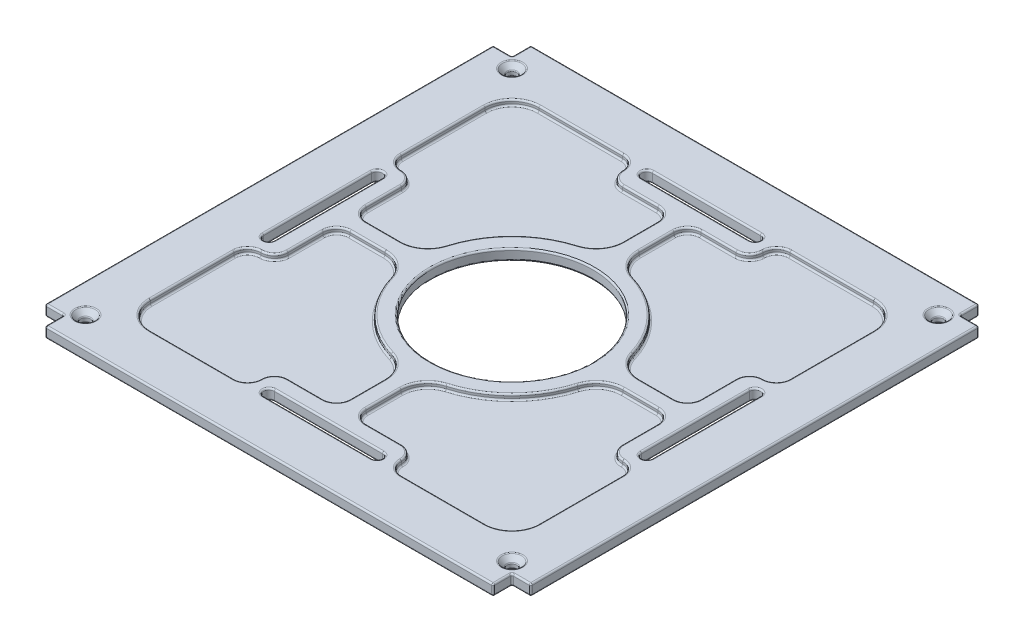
SolidWorks part; units mm, degrees
ref_plane "Front Plane" through (0, 0, 0) normal (0, 0, 1) x (1, 0, 0)
ref_plane "Top Plane" through (0, 0, 0) normal (0, 1, 0) x (1, 0, 0)
ref_plane "Right Plane" through (0, 0, 0) normal (1, 0, 0) x (0, 0, -1)
imported_body "Stock-cubesat - Master-1"
sketch "Sketch1" plane through (0, 50, 0) normal (0, 1, 0) x (1, 0, 0)
  circle A0 centre (0, 0) radius 15
extrude "Cut-Extrude1" cut sketch "Sketch1" against normal blind 10
sketch "Sketch2" plane through (0, 50, 0) normal (0, 1, 0) x (1, 0, 0)
  line L0 (-35, 10) -> (-35, -10) construction
  line L1 (-34, 10) -> (-34, -10)
  line L2 (-36, 10) -> (-36, -10)
  line L3 (-41.5, -41.5) -> (0, 0) construction
  line L4 (0, 0) -> (41.5, -41.5) construction
  line L5 (-35, 0) -> (0, 0) construction
  line L6 (10, -35) -> (-10, -35) construction
  line L7 (10, -34) -> (-10, -34)
  line L8 (10, -36) -> (-10, -36)
  line L9 (-10, 35) -> (10, 35) construction
  line L10 (-10, 34) -> (10, 34)
  line L11 (-10, 36) -> (10, 36)
  line L12 (35, -10) -> (35, 10) construction
  line L13 (34, -10) -> (34, 10)
  line L14 (36, -10) -> (36, 10)
  arc A0 (-34, 10) -> (-36, 10) centre (-35, 10) ccw
  arc A1 (-36, -10) -> (-34, -10) centre (-35, -10) ccw
  arc A2 (10, -34) -> (10, -36) centre (10, -35) cw
  arc A3 (-10, -36) -> (-10, -34) centre (-10, -35) cw
  arc A4 (-10, 34) -> (-10, 36) centre (-10, 35) cw
  arc A5 (10, 36) -> (10, 34) centre (10, 35) cw
  arc A6 (34, -10) -> (36, -10) centre (35, -10) ccw
  arc A7 (36, 10) -> (34, 10) centre (35, 10) ccw
  point P2 (-35, 0)
  point P16 (0, -35)
  point P23 (0, 35)
  point P30 (35, 0)
extrude "Cut-Extrude2" cut sketch "Sketch2" against normal blind 10
sketch "Sketch3" plane through (0, 50, 0) normal (0, 1, 0) x (1, 0, 0)
  line L0 (0, 31) -> (0, -31) construction
  line L1 (31, -31) -> (-31, -31)
  line L2 (31, -31) -> (31, 31)
  line L3 (31, 31) -> (-31, 31)
  line L4 (-31, -31) -> (-31, 31)
  line L5 (31, -31) -> (-31, 31) construction
  line L6 (31, 31) -> (-31, -31) construction
  line L7 (-31, 0) -> (31, 0) construction
  line L8 (-1.5, 31) -> (-1.5, -31)
  line L9 (-31, -1.5) -> (31, -1.5)
  line L10 (1.5, 31) -> (1.5, -31)
  line L11 (-31, 1.5) -> (31, 1.5)
  line L12 (-13, 36) -> (-36, 36)
  line L13 (-36, 13) -> (-36, 36)
  line L14 (-36, 13) -> (-31, 13)
  line L15 (-13, 36) -> (-13, 31)
  line L16 (13, 36) -> (36, 36)
  line L17 (36, 13) -> (36, 36)
  line L18 (13, 36) -> (13, 31)
  line L19 (36, 13) -> (31, 13)
  line L20 (36, -13) -> (36, -36)
  line L21 (13, -36) -> (36, -36)
  line L22 (36, -13) -> (31, -13)
  line L23 (13, -36) -> (13, -31)
  line L24 (-13, -36) -> (-36, -36)
  line L25 (-36, -13) -> (-36, -36)
  line L26 (-13, -36) -> (-13, -31)
  line L27 (-36, -13) -> (-31, -13)
  circle A2 centre (0, 0) radius 18
  circle A3 centre (0, 0) radius 18
  point P42 (0, 0)
  dimension "D2" = 1.5
  dimension "D4" = 4
  dimension "D1" = 3
  dimension "D3" = 1.5
extrude "Cut-Extrude5" cut sketch "Sketch3" against normal blind 1 contours L4 L1 L2 L3 A3 | A3 L11 L2 L3 L10 | A3 L10 L1 L2 L9 | A3 L9 L4 L1 L8 | L15 L12 L13 L14 L4 L3 | L19 L17 L16 L18 L3 L2 | L23 L21 L20 L22 L2 L1 | L27 L25 L24 L26 L1 L4
fillet "Fillet1" radius 5 12 edges at (1.5, 49.5, -17.9374) (17.9374, 49.5, -1.5) (-36, 49.5, 36) (36, 49.5, 36) (-1.5, 49.5, 17.9374) (-17.9374, 49.5, 1.5) (1.5, 49.5, 17.9374) (17.9374, 49.5, 1.5) (36, 49.5, -36) (-36, 49.5, -36) (-1.5, 49.5, -17.9374) (-17.9374, 49.5, -1.5)
fillet "Fillet4" radius 2.5 24 edges at (-36, 49.5, 13) (-31, 49.5, -1.5) (-31, 49.5, 1.5) (31, 49.5, 1.5) (36, 49.5, 13) (1.5, 49.5, -31) (13, 49.5, -36) (-13, 49.5, -36) (-13, 49.5, -31) (-1.5, 49.5, -31) (13, 49.5, -31) (-36, 49.5, -13) (-31, 49.5, -13) (31, 49.5, -1.5) (31, 49.5, -13) (36, 49.5, -13) (31, 49.5, 13) (-13, 49.5, 36) (-1.5, 49.5, 31) (-13, 49.5, 31) (-31, 49.5, 13) (1.5, 49.5, 31) (13, 49.5, 31) (13, 49.5, 36)
fillet "Fillet5" radius 0.3 99 edges at (13.7322, 50, 35.2678) (2.2322, 50, 30.2678) (-31.7322, 49, 12.2678) (-2.2322, 50, 30.2678) (31.7322, 49, -12.2678) (-31.7322, 49, -12.2678) (-12.2678, 49, -31.7322) (35.2678, 50, 13.7322) (-30.2678, 50, 2.2322) (-30.2678, 50, -2.2322) (31.7322, 50, 12.2678) (-12.2678, 50, 31.7322) (2.2322, 49, -30.2678) (13.7322, 49, -35.2678) (30.2678, 49, 2.2322) (2.2322, 49, 30.2678) (-13.7322, 49, -35.2678) (-30.2678, 49, 2.2322) (-2.2322, 49, 30.2678) (34.5355, 50, -34.5355) (19.0679, 50, 2.4959) (-19.0679, 50, 2.4959) (-2.4959, 50, 19.0679) (34.5355, 50, 34.5355) (19.0679, 50, -2.4959) (-2.4959, 50, -19.0679) (-34.5355, 49, 34.5355) (-2.4959, 49, 19.0679) (-19.0679, 49, 2.4959) (2.4959, 49, -19.0679) (19.0679, 49, -2.4959) (34.5355, 49, -34.5355) (-2.4959, 49, -19.0679) (-11, 48, -35) (11, 48, -35) (0, 48, -34) (0, 48, 36) (-11, 48, 35) (0, 48, 34) (-35, 48, -11) (-34, 48, 0) (-36, 48, 0) (-39.5, 49, -38.6) (39.5, 49, -38.6) (-39.5, 50, -37.6) (45, 49, 41.5) (45, 49, -41.5) (41.5, 49, -41.5) (41.5, 49, -45) (-45, 49, -41.5) (-45, 49, 41.5) (-41.5, 49, 45) (41.5, 49, 45) (41.5, 49, 41.5) (-43.25, 50, 41.5) (-45, 50, 0) (-41.5, 50, -43.25) (41.5, 48, 43.25) (-41.5, 48, 43.25) (-43.25, 48, 41.5) (-45, 48, 0) (-41.5, 48, -43.25) (0, 48, -45) (-39.5, 48, -38.6) (39.5, 48, -38.6) (-34, 50, 0) (-36, 50, 0) (-11, 50, 35) (11, 50, 35) (0, 50, -36) (11, 50, -35) (34, 50, 0) (35, 50, -11) (35, 50, 11) (-36, 49, -23.25) (-7.25, 49, -31) (-1.5, 49, -25.2812) (-12.7279, 49, -12.7279) (-25.2812, 50, -1.5) (25.2812, 50, -1.5) (-31, 50, -7.25) (-31, 50, 7.25) (23.25, 49, -36) (31, 49, -7.25) (25.2812, 49, -1.5) (12.7279, 49, -12.7279) (-7.25, 50, -31) (7.25, 50, -31) (23.25, 50, -36) (36, 50, -23.25) (12.7279, 49, 12.7279) (25.2812, 50, 1.5) (-25.2812, 50, 1.5) (-1.5, 49, 25.2812) (-23.25, 49, 36) (-31, 49, 7.25) (7.25, 50, 31) (-7.25, 50, 31) (-36, 50, 23.25)
